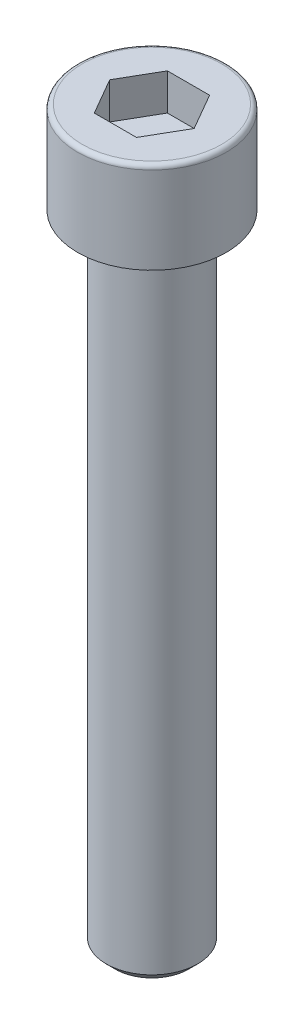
SolidWorks part; units mm, degrees
ref_plane "Plan1" through (0, 0, 0) normal (0, 0, 1) x (1, 0, 0)
ref_plane "Plan2" through (0, 0, 0) normal (0, 1, 0) x (1, 0, 0)
ref_plane "Plan3" through (0, 0, 0) normal (1, 0, 0) x (0, 0, -1)
sketch "Esquisse1" plane through (0, 0, 0) normal (0, 0, 1) x (1, 0, 0)
  line L0 (0, 54.8028) -> (0, -12.6844) construction
  line L1 (0, 80) -> (-7.635, 80)
  line L3 (-8.135, 79.5) -> (-8.135, 70)
  line L4 (-8.135, 70) -> (-5, 70)
  line L7 (-5, 70) -> (-5, 0)
  line L12 (-5, 0) -> (0, 0)
  line L13 (0, 80) -> (0, 0)
  arc A0 (-8.135, 79.5) -> (-7.635, 80) centre (-7.635, 79.5) cw
  dimension "D1" = 0.5
  dimension "D2" = 16.27
  dimension "D3" = 70
  dimension "D4" = 10
  dimension "D5" = 10
revolve "Base-Révolution" add sketch "Esquisse1" angle 360 about L0
chamfer "Chanfrein1" distance 1 angle 45
sketch "Esquisse4" plane through (0, 80, 0) normal (0, 1, 0) x (-1, 0, 0)
  line L1 (2.3094, 4) -> (-2.3094, 4)
  line L2 (-2.3094, 4) -> (-4.6188, 0)
  line L3 (-4.6188, 0) -> (-2.3094, -4)
  line L4 (-2.3094, -4) -> (2.3094, -4)
  line L5 (2.3094, -4) -> (4.6188, 0)
  line L6 (4.6188, 0) -> (2.3094, 4)
  circle A0 centre (0, 0) radius 4 construction
  dimension "D1" = 8
extrude "Enlèv. mat.-Extru.3" cut sketch "Esquisse4" against normal blind 4
